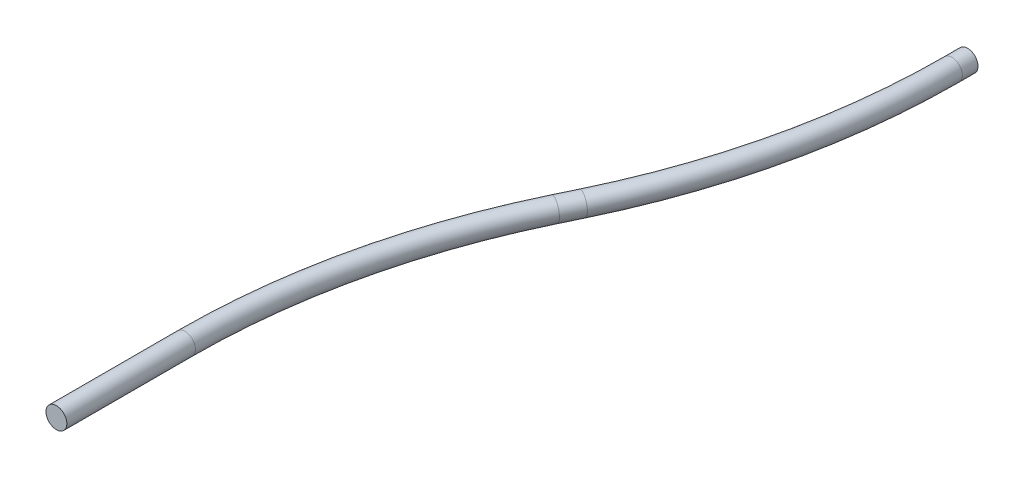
SolidWorks part; units mm, degrees
ref_plane "Front" through (0, 0, 0) normal (0, 0, 1) x (1, 0, 0)
ref_plane "Top" through (0, 0, 0) normal (0, 1, 0) x (1, 0, 0)
ref_plane "Right" through (0, 0, 0) normal (1, 0, 0) x (0, 0, -1)
sketch "circle" plane through (0, 0, 0) normal (0, 0, 1) x (1, 0, 0)
  circle A0 centre (0, 0) radius 1.524
  dimension "D1" = 3.048
sketch "Sketch2" plane through (0, 0, 0) normal (0, 1, 0) x (1, 0, 0)
  line L0 (0, 0) -> (0, 18.7888)
  line L1 (21.336, 111.76) -> (21.336, 109.4812)
  line L2 (10.0053, 62.7543) -> (11.3307, 65.5157)
  arc A0 (21.336, 109.4812) -> (11.3307, 65.5157) centre (-80.264, 109.4812) cw
  arc A1 (0, 18.7888) -> (10.0053, 62.7543) centre (101.6, 18.7888) cw
  point P7 (21.336, 86.36)
  point P10 (0, 41.91)
  dimension "D5" = 101.6
  dimension "D6" = 101.6
  dimension "D1" = 111.76
  dimension "D2" = 25.4
  dimension "D3" = 41.91
  dimension "D4" = 21.336
sweep "Sweep1" add profiles "circle" path "Sketch2"
